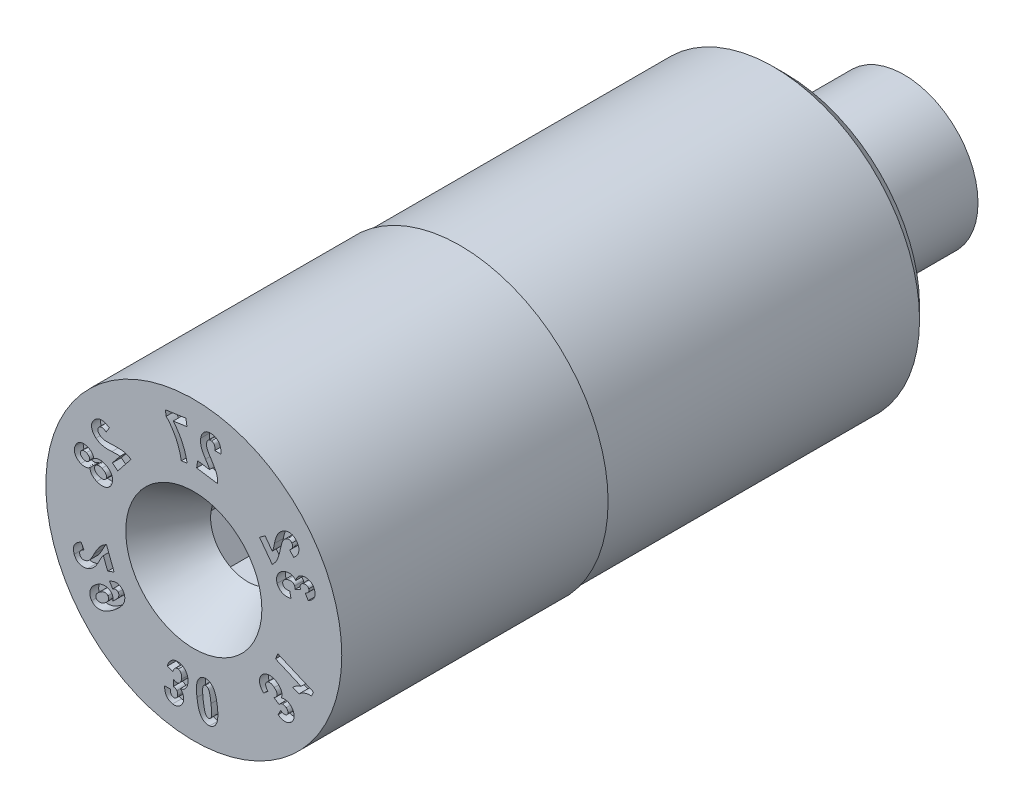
SolidWorks part; units mm, degrees
other "<M5L8-SetScrew>-<Chamfer1>"
ref_plane "Front Plane" through (0, 0, 0) normal (0, 0, 1) x (1, 0, 0)
ref_plane "Top Plane" through (0, 0, 0) normal (0, 1, 0) x (1, 0, 0)
ref_plane "Right Plane" through (0, 0, 0) normal (1, 0, 0) x (0, 0, -1)
sketch "Sketch1" plane through (0, 0, 0) normal (1, 0, 0) x (0, 0, -1)
  line L0 (0, 2.3) -> (1.8187, 1.25)
  line L2 (0, 5) -> (0, 2.3)
  line L3 (19.525, 5) -> (0, 5)
  line L4 (-3.7979, 0) -> (49996.2021, 0) construction
  line L8 (16, 1.25) -> (1.8187, 1.25)
  line L12 (20, 2.5) -> (20, 4.525)
  line L16 (20, 4.525) -> (19.525, 5)
  line L17 (20, 2.5) -> (16, 2.5)
  line L18 (16, 1.25) -> (16, 2.5)
  dimension "D1" = 20
  dimension "D2" = 45
  dimension "D3" = 0.475
  dimension "D4" = 10
  dimension "D5" = 30
  dimension "D6" = 2.3
  dimension "D7" = 2.5
  dimension "D8" = 5
  dimension "D9" = 4
revolve "Revolve1" add sketch "Sketch1" angle 360 about L4
sketch "Sketch5" plane through (0, 0, 0) normal (1, 0, 0) x (0, 0, -1)
  line L0 (0, 0) -> (50000, 0) construction
  line L1 (0, 5) -> (0, -5) construction
  line L2 (9, 4.935) -> (20, 4.935)
  line L3 (9, 4.935) -> (9, 5.935)
  line L4 (9, 5.935) -> (20, 5.935)
  line L5 (20, 4.935) -> (20, 5.935)
  line L6 (20, -4.525) -> (20, 4.525) construction
  line L7 (19.525, 5) -> (0, 5) construction
  dimension "D1" = 9
  dimension "D2" = 0.065
  dimension "D3" = 1
revolve "Cut-Revolve1" cut sketch "Sketch5" angle 360 about L0
sketch "Sketch2" plane through (0, 0, 0) normal (0, 0, 1) x (1, 0, 0)
  line L0 (0, 0) -> (0, 5) construction
  line L1 (0, 0) -> (4.3301, 2.5) construction
  line L2 (0, 0) -> (4.3301, -2.5) construction
  line L3 (0, 0) -> (0, -5) construction
  line L4 (0, 0) -> (-4.3301, -2.5) construction
  line L5 (0, 0) -> (-4.3301, 2.5) construction
  arc A0 (0.8445, 2.9254) -> (1.4772, 2.6626) centre (0, 0) ccw construction
  circle A1 centre (0, 0) radius 5 construction
  text T0 "27   28   29   30   31   32" font "Arial Narrow" height 1.3
  point P17 (0, 0)
  dimension "D1" = 3.0449
  dimension "D2" = 6
extrude "Cut-Extrude1" cut sketch "Sketch2" against normal blind 0.3
ref_plane "Plane1" through (0, 0, -1.8187) normal (0, 0, 1) x (1, 0, 0)
sketch "Sketch6" plane through (0, 0, -1.8187) normal (0, 0, 1) x (1, 0, 0)
  line L1 (1.4434, 0) -> (0.7217, 1.25)
  line L2 (0.7217, 1.25) -> (-0.7217, 1.25)
  line L3 (-0.7217, 1.25) -> (-1.4434, 0)
  line L4 (-1.4434, 0) -> (-0.7217, -1.25)
  line L5 (-0.7217, -1.25) -> (0.7217, -1.25)
  line L6 (0.7217, -1.25) -> (1.4434, 0)
  circle A0 centre (0, 0) radius 1.25 construction
  circle A1 centre (0, 0) radius 1.25 construction
  point P1 (0, 1.25)
extrude "Cut-Extrude2" cut sketch "Sketch6" against normal blind 2.5
inserted part "M5L8-SetScrew"
move or copy body "Body-Move/Copy2" placed by mates yes
other "Distance1" parameters "D1"=4
